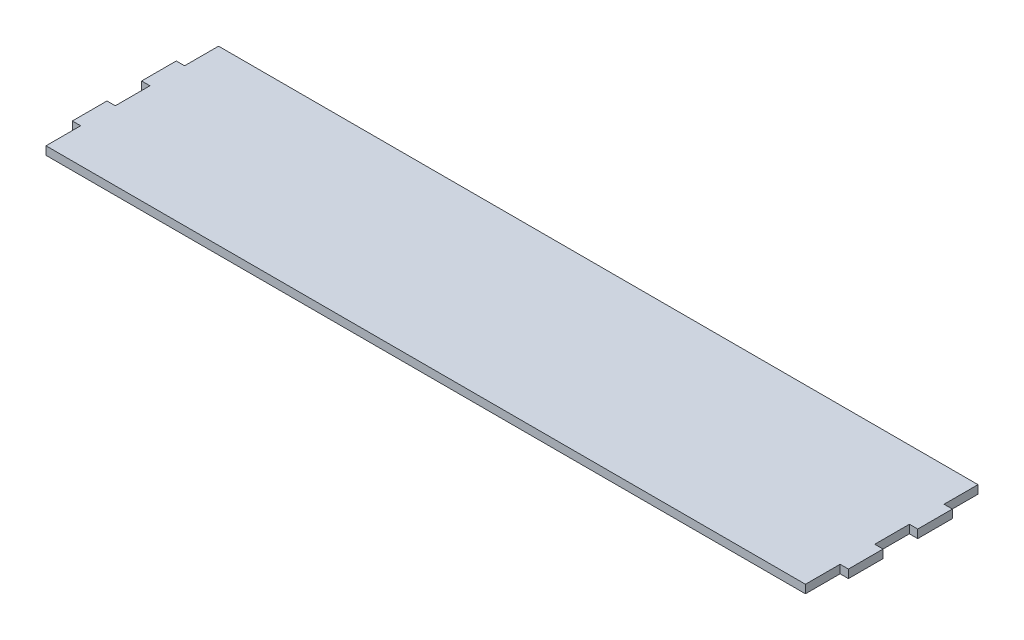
SolidWorks part; units mm, degrees
ref_plane "Alzado" through (0, 0, 0) normal (0, 0, 1) x (1, 0, 0)
ref_plane "Planta" through (0, 0, 0) normal (0, 1, 0) x (1, 0, 0)
ref_plane "Vista lateral" through (0, 0, 0) normal (1, 0, 0) x (0, 0, -1)
sketch "Croquis1" plane through (0, 0, 0) normal (0, 1, 0) x (1, 0, 0)
  line L0 (-560, 25) -> (-560, 75)
  line L1 (-548, -125) -> (548, -125)
  line L2 (-548, -125) -> (-548, -75)
  line L3 (-548, 125) -> (548, 125)
  line L5 (-548, -125) -> (548, 125) construction
  line L6 (-548, 125) -> (548, -125) construction
  line L7 (-548, -75) -> (-560, -75)
  line L9 (-548, -25) -> (-560, -25)
  line L10 (-560, -75) -> (-560, -25)
  line L11 (-548, 75) -> (-560, 75)
  line L13 (-548, 25) -> (-560, 25)
  line L18 (0, 125) -> (0, 142.0008) construction
  line L31 (-548, 75) -> (-548, 125)
  line L32 (548, -125) -> (548, -75)
  line L34 (548, 75) -> (548, 125)
  line L35 (-548, -25) -> (-548, 25)
  line L39 (548, -25) -> (548, 25)
  line L40 (548, 25) -> (560, 25)
  line L41 (548, 75) -> (560, 75)
  line L42 (560, -75) -> (560, -25)
  line L43 (548, -25) -> (560, -25)
  line L44 (548, -75) -> (560, -75)
  line L45 (560, 25) -> (560, 75)
  point P0 (0, 0)
extrude "Saliente-Extruir1" add sketch "Croquis1" along normal blind 12
sketch "Croquis2" plane through (0, 0, 0) normal (0, 1, 0) x (1, 0, 0)
  line L0 (548, 75) -> (548, 125) construction
  line L1 (-548, 125) -> (548, 125)
  line L2 (-548, 125) -> (-548, 124)
  line L3 (-548, 124) -> (548, 124)
  line L4 (548, 125) -> (548, 124)
  dimension "D1" = 1
extrude "Cortar-Extruir2" cut sketch "Croquis2" along normal through all
equation "\"ancho\"= \"ancho_joint\" * 5"
equation "\"alto\"= \"largo\" - \"material\" * 2"
equation "\"material\"= 1.2"
equation "\"ancho_joint_sep\"=3.75"
equation "\"ancho_joint\"= 5"
equation "\"D4@Croquis1\"=\"ancho_joint\""
equation "\"D5@Croquis1\"=\"material\""
equation "\"D3@Croquis1\"=\"ancho_joint\""
equation "\"D7@Croquis1\"=\"ancho_joint\""
equation "\"D8@Croquis1\"=\"ancho_joint\""
equation "\"D1@Croquis1\"=\"alto\""
equation "\"D1@Saliente-Extruir1\"=\"material\""
equation "\"largo\"= 112"
